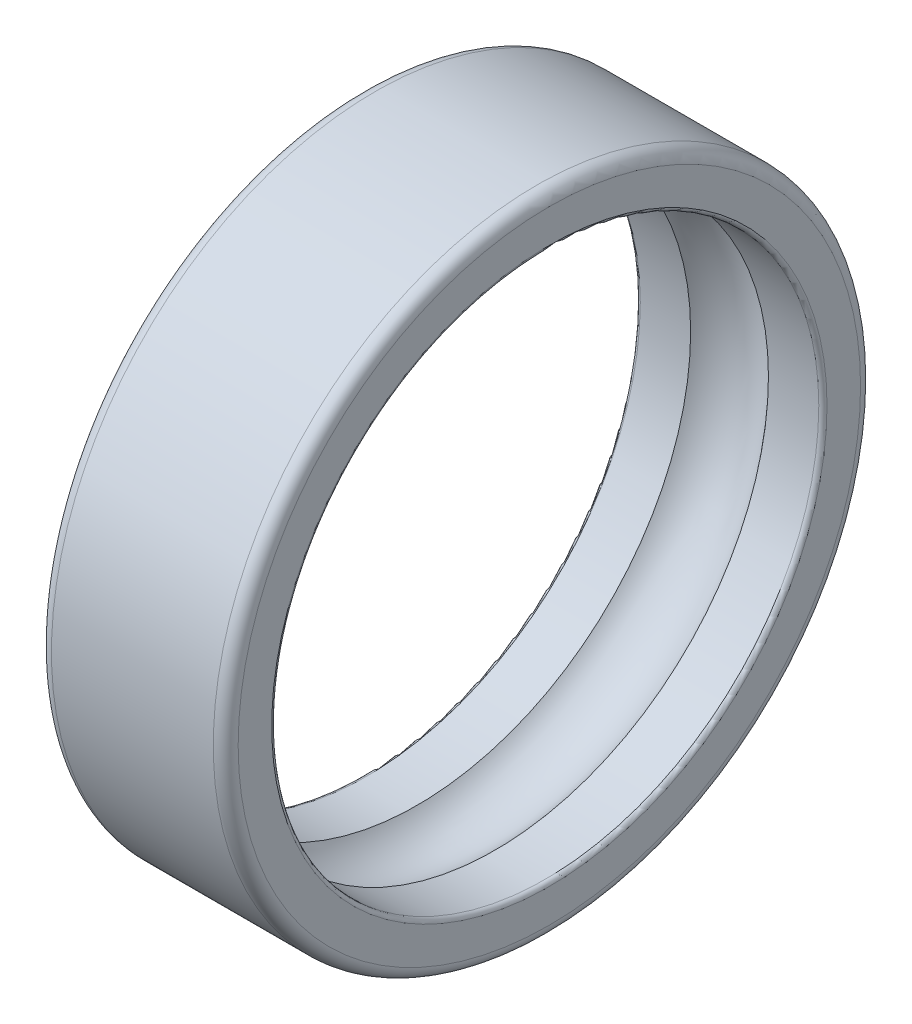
SolidWorks part; units mm, degrees
ref_plane "Přední rovina" through (0, 0, 0) normal (0, 0, 1) x (1, 0, 0)
ref_plane "Horní rovina" through (0, 0, 0) normal (0, 1, 0) x (1, 0, 0)
ref_plane "Pravá rovina" through (0, 0, 0) normal (1, 0, 0) x (0, 0, -1)
sketch "Skica1" plane through (0, 0, 0) normal (0, 0, 1) x (1, 0, 0)
  line L0 (0, 0) -> (0, 42.4552) construction
  line L1 (15, 22.305) -> (15, 25)
  line L2 (91.4364, 0) -> (0, 0) construction
  line L3 (1, 26) -> (14, 26)
  line L5 (0, 25) -> (0, 22.305)
  line L6 (7.5, 21.975) -> (7.5, 26) construction
  line L10 (14.67, 21.975) -> (10.625, 21.975)
  line L11 (0.33, 21.975) -> (4.375, 21.975)
  arc A0 (14.67, 21.975) -> (15, 22.305) centre (14.67, 22.305) ccw
  arc A1 (0, 22.305) -> (0.33, 21.975) centre (0.33, 22.305) ccw
  arc A2 (14, 26) -> (15, 25) centre (14, 25) cw
  arc A3 (1, 26) -> (0, 25) centre (1, 25) ccw
  arc A5 (10.625, 21.975) -> (4.375, 21.975) centre (7.5, 19.5281) ccw
  point P12 (0, 21.975)
  point P15 (15, 26)
  point P18 (0, 26)
  dimension "D4" = 0.33
  dimension "D5" = 1
  dimension "D6" = 6.25
  dimension "D1" = 21.975
  dimension "D2" = 26
  dimension "D3" = 15
revolve "Rotovat1" add sketch "Skica1" angle 360 about L2
